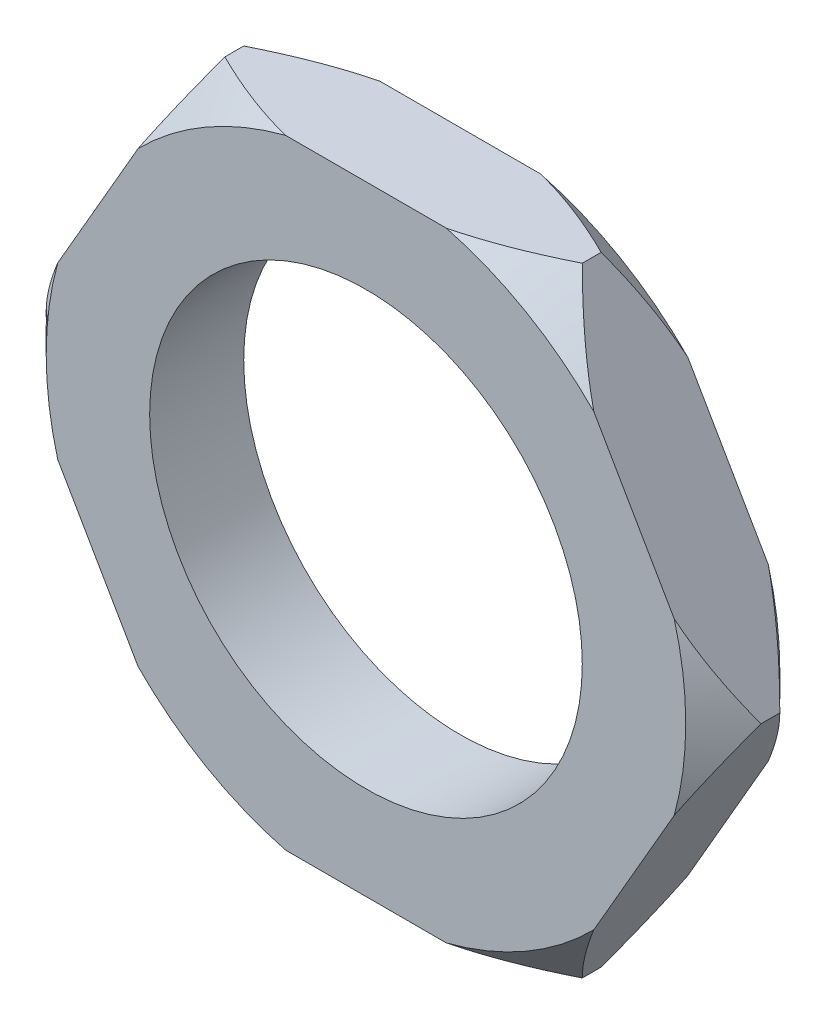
SolidWorks part; units mm, degrees
ref_plane "Plan de face" through (0, 0, 0) normal (0, 0, 1) x (1, 0, 0)
ref_plane "Plan de dessus" through (0, 0, 0) normal (0, 1, 0) x (1, 0, 0)
ref_plane "Plan de droite" through (0, 0, 0) normal (1, 0, 0) x (0, 0, -1)
sketch "Esquisse1" plane through (0, 0, 0) normal (0, 0, 1) x (1, 0, 0)
  line L0 (-13.1452, 0) -> (14.6889, 0) construction
  line L1 (0, -11.1992) -> (0, 11.3919) construction
  circle A0 centre (0, 0) radius 9.5
  circle A1 centre (0, 0) radius 5.75
  dimension "D1" = 19
  dimension "D2" = 11.5
extrude "Boss.-Extru.1" add sketch "Esquisse1" along normal blind 2.5
chamfer "Chanfrein1" distance 1 angle 45 2 edges at (9.5, 0, 2.5) (9.5, 0, 0)
sketch "Esquisse3" plane through (0, 0, 2.5) normal (0, 0, 1) x (1, 0, 0)
  line L0 (0, 0) -> (-11.573, 0) construction
  line L2 (-9.5, 0) -> (-4.75, -8.2272)
  line L3 (-4.75, -8.2272) -> (4.75, -8.2272)
  line L4 (4.75, -8.2272) -> (9.5, 0)
  line L5 (9.5, 0) -> (4.75, 8.2272)
  line L6 (4.75, 8.2272) -> (-4.75, 8.2272)
  line L7 (-4.75, 8.2272) -> (-9.5, 0)
  circle A0 centre (0, 0) radius 8.2272 construction
  dimension "D1" = 16.4545
  dimension "D2" = 8.2272
extrude "Enlèv. mat.-Extru.1" cut sketch "Esquisse3" against normal blind 2.5 flip side to cut
